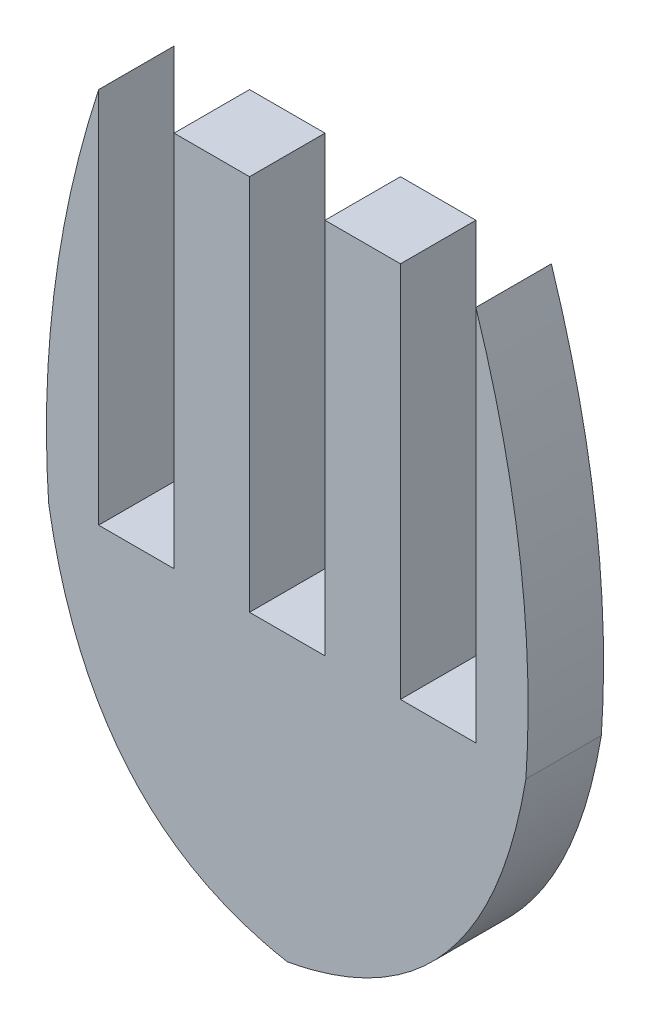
SolidWorks part; units mm, degrees
ref_plane "Alzado" through (0, 0, 0) normal (0, 0, 1) x (1, 0, 0)
ref_plane "Planta" through (0, 0, 0) normal (0, 1, 0) x (1, 0, 0)
ref_plane "Vista lateral" through (0, 0, 0) normal (1, 0, 0) x (0, 0, -1)
sketch "Croquis1" plane through (0, 0, 0) normal (0, 0, 1) x (1, 0, 0)
  line L0 (-7.0348, 17.2979) -> (-7.0348, 2.2979)
  line L1 (-7.0348, 2.2979) -> (-4.0348, 2.2979)
  line L3 (-4.0348, 2.2979) -> (-4.0348, 17.2979)
  line L4 (-1.0348, 2.2979) -> (-1.0348, 17.2979)
  line L5 (-4.0348, 17.2979) -> (-1.0348, 17.2979)
  line L6 (-1.0348, 2.2979) -> (1.9652, 2.2979)
  line L7 (0.4652, -16.6194) -> (0.4652, 25.7337) construction
  line L8 (-7.6039, -2.7021) -> (13.3689, -2.7021) construction
  line L9 (1.9652, 2.2979) -> (1.9652, 17.2979)
  line L10 (1.9652, 17.2979) -> (4.9652, 17.2979)
  line L11 (4.9652, 17.2979) -> (4.9652, 2.2979)
  line L12 (4.9652, 2.2979) -> (7.9652, 2.2979)
  line L13 (7.9652, 2.2979) -> (7.9652, 17.2979)
  spline S0 degree 2 poles (-9.0228, 2.0497) (-7.4066, -7.5644) (0.4652, -8.9873) knots 0 0 0 1 1 1
  spline S1 degree 2 poles (9.9532, 2.0497) (8.3371, -7.5644) (0.4652, -8.9873) knots 0 0 0 1 1 1
  spline S2 degree 2 poles (-7.0348, 17.2979) (-9.535, 9.5555) (-9.0228, 2.0497) knots 0 0 0 0.883495 0.883495 0.883495
  spline S3 degree 2 poles (7.9652, 17.2979) (10.4654, 9.5555) (9.9532, 2.0497) knots 0 0 0 0.883495 0.883495 0.883495
  dimension "D1" = 3
  dimension "D2" = 3
  dimension "D3" = 15
  dimension "D4" = 3
  dimension "D5" = 15
  dimension "D6" = 20
  dimension "D7" = 3
  dimension "D8" = 3
  dimension "D9" = 15
extrude "Saliente-Extruir1" add sketch "Croquis1" along normal blind 3 contours L3 L5 L4 L6 L9 L10 L11 L12 L13 S3 S1 S0 S2 L0 L1
